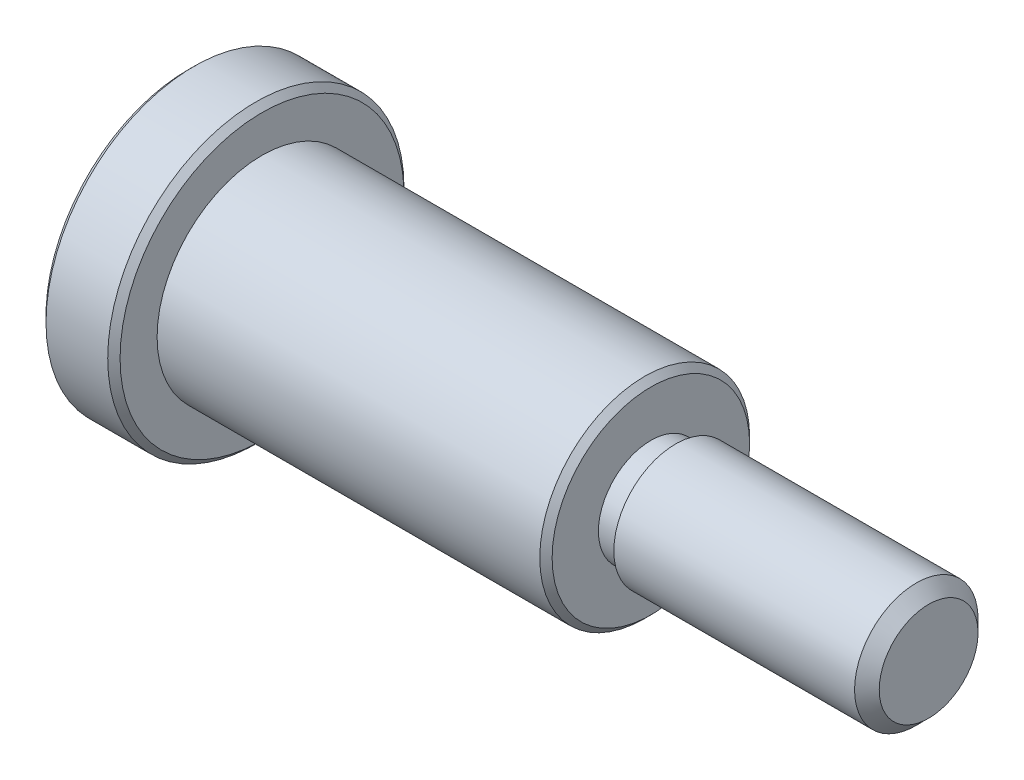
SolidWorks part; units mm, degrees
ref_plane "Plan de face" through (0, 0, 0) normal (0, 0, 1) x (1, 0, 0)
ref_plane "Plan de dessus" through (0, 0, 0) normal (0, 1, 0) x (1, 0, 0)
ref_plane "Plan de droite" through (0, 0, 0) normal (1, 0, 0) x (0, 0, -1)
sketch "Esquisse1" plane through (0, 0, 0) normal (0, 0, 1) x (1, 0, 0)
  line L0 (-44.5184, 0) -> (117.461, 0) construction
  line L1 (37.5, 4.25) -> (39.5, 4.25)
  line L2 (0, 12) -> (6, 12)
  line L3 (0, 12) -> (0, 0)
  line L4 (39.5, 4.25) -> (39.5, 5)
  line L5 (6, 12) -> (6, 8.5)
  line L6 (6, 8.5) -> (37.5, 8.5)
  line L7 (60, 5) -> (60, 0)
  line L8 (60, 0) -> (0, 0)
  line L9 (37.5, 8.5) -> (37.5, 4.25)
  line L14 (39.5, 5) -> (60, 5)
  dimension "D1" = 6
  dimension "D2" = 12
  dimension "D3" = 31.5
  dimension "D4" = 2
  dimension "D5" = 8.5
  dimension "D6" = 4.25
  dimension "D7" = 5
  dimension "D8" = 54
revolve "Révolution1" add sketch "Esquisse1" angle 360 about L0
hole_wizard "Diamètre du perçage Ø10.0 (10)1" positions "Esquisse3" profile "Esquisse2" hole size "Ø10.0" standard "Iso"
sketch "Esquisse3" plane through (0, 0, 0) normal (-1, 0, 0) x (0, 0, 1)
  point P0 (0, 0)
sketch "Esquisse2" plane through (0, 0, 0) normal (0, 1, 0) x (0, 0, 1)
  line L0 (0, 0) -> (0, 13.0043)
  line L1 (0, 13.0043) -> (5, 10)
  line L2 (5, 10) -> (5, 0)
  line L5 (5, 0) -> (0, 0)
  line L10 (0, 13.0043) -> (-5, 10) construction
  line L11 (0, -6.35) -> (0, 107.95) construction
  dimension "Diamètre du perçage" = 10
  dimension "Profondeur du perçage" = 10
  dimension "Angle de pointe" = 118
chamfer "Chanfrein1" distance 1 angle 45 2 edges at (60, 0, 5) (0, 0, 5)
chamfer "Chanfrein2" distance 0.5 angle 45 3 edges at (0, 0, 12) (6, 0, 12) (37.5, 0, 8.5)
sketch "Esquisse4" plane through (0, 0, 0) normal (-1, 0, 0) x (0, 0, 1)
  line L1 (5.1962, 3) -> (0, 6)
  line L2 (0, 6) -> (-5.1962, 3)
  line L3 (-5.1962, 3) -> (-5.1962, -3)
  line L4 (-5.1962, -3) -> (0, -6)
  line L5 (0, -6) -> (5.1962, -3)
  line L6 (5.1962, -3) -> (5.1962, 3)
  circle A0 centre (0, 0) radius 5.1962 construction
  circle A1 centre (0, 0) radius 6 construction
extrude "Enlèv. mat.-Extru.1" cut sketch "Esquisse4" against normal blind 10
